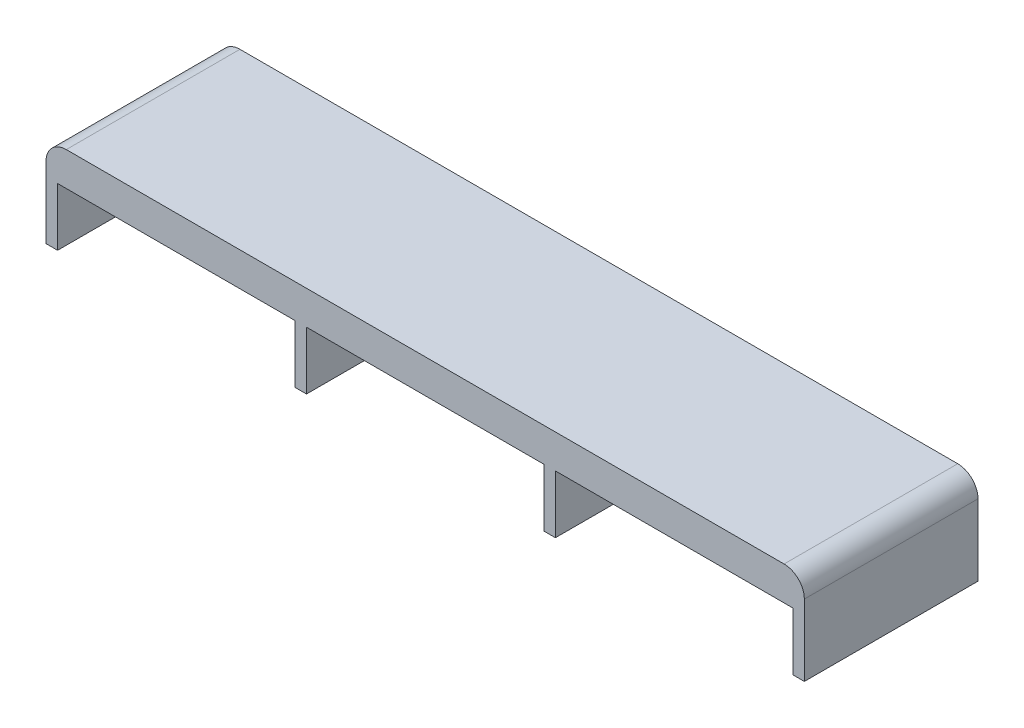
SolidWorks part; units mm, degrees
ref_plane "Front Plane" through (0, 0, 0) normal (0, 0, 1) x (1, 0, 0)
ref_plane "Top Plane" through (0, 0, 0) normal (0, 1, 0) x (1, 0, 0)
ref_plane "Right Plane" through (0, 0, 0) normal (1, 0, 0) x (0, 0, -1)
sketch "Sketch1" plane through (0, 0, 0) normal (0, 0, 1) x (1, 0, 0)
  line B0 (-655, -100) -> (-635, -100)
  line B1 (-635, -100) -> (-635, 0)
  line B2 (-635, 0) -> (-225, 0)
  line B3 (-225, 0) -> (-225, -100)
  line B4 (-225, -100) -> (-205, -100)
  line B5 (-205, -100) -> (-205, 0)
  line B6 (-205, 0) -> (205, 0)
  line B7 (205, 0) -> (205, -100)
  line B8 (205, -100) -> (225, -100)
  line B9 (225, -100) -> (225, 0)
  line B10 (225, 0) -> (635, 0)
  line B11 (635, 0) -> (635, -100)
  line B12 (635, -100) -> (655, -100)
  line B13 (430.4379, 856.7859) -> (365.0355, 258.6308)
  line B14 (265.6279, 169.5) -> (-269.4149, 169.5)
  line B15 (-368.2666, 254.3889) -> (-460.4156, 857.1976)
  line B16 (0, 0) -> (0, 169.5) construction
  circle B17 centre (492.5, 850) radius 12.5
  circle B18 centre (-507.5, 850) radius 12.5
  line B19 (-655, -100) -> (-655, 165.6038)
  line B20 (-641.713, 328.0767) -> (-554.4985, 857.7388)
  arc B21 (-460.4156, 857.1976) -> (-554.4985, 857.7388) centre (-507.5, 850) ccw
  line B22 (655, -100) -> (655, 165.6038)
  line B23 (641.713, 328.0767) -> (554.1025, 860.1435)
  arc B24 (554.1025, 860.1435) -> (430.4379, 856.7859) centre (492.5, 850) ccw
  arc B25 (-269.4149, 169.5) -> (-368.2666, 254.3889) centre (-269.4149, 269.5) cw
  arc B26 (365.0355, 258.6308) -> (265.6279, 169.5) centre (265.6279, 269.5) cw
  arc B27 (641.713, 328.0767) -> (655, 165.6038) centre (-345, 165.6038) cw
  arc B28 (-655, 165.6038) -> (-641.713, 328.0767) centre (345, 165.6038) cw
  line B29 (-655, 58.2439) -> (655, 58.2439)
  line B30 (492.5, 850) -> (492.5, 58.2439) construction
  line B31 (-507.5, 850) -> (-490.7199, 58.2439) construction
sketch_block_instance "grabber-2"
sketch_block "grabber" parameters "D3"=100, "D4"=1000, "D1"=317.4884, "D2"=965
extrude "Extrude1" add sketch "Sketch1" along normal mid plane 300 contours B19 B0 B1 B2 B3 B4 B5 B6 B7 B8 B9 B10 B11 B12 B22 B29
fillet "Fillet1" radius 35 2 edges at (-655, 58.2439, 0) (655, 58.2439, 0)
